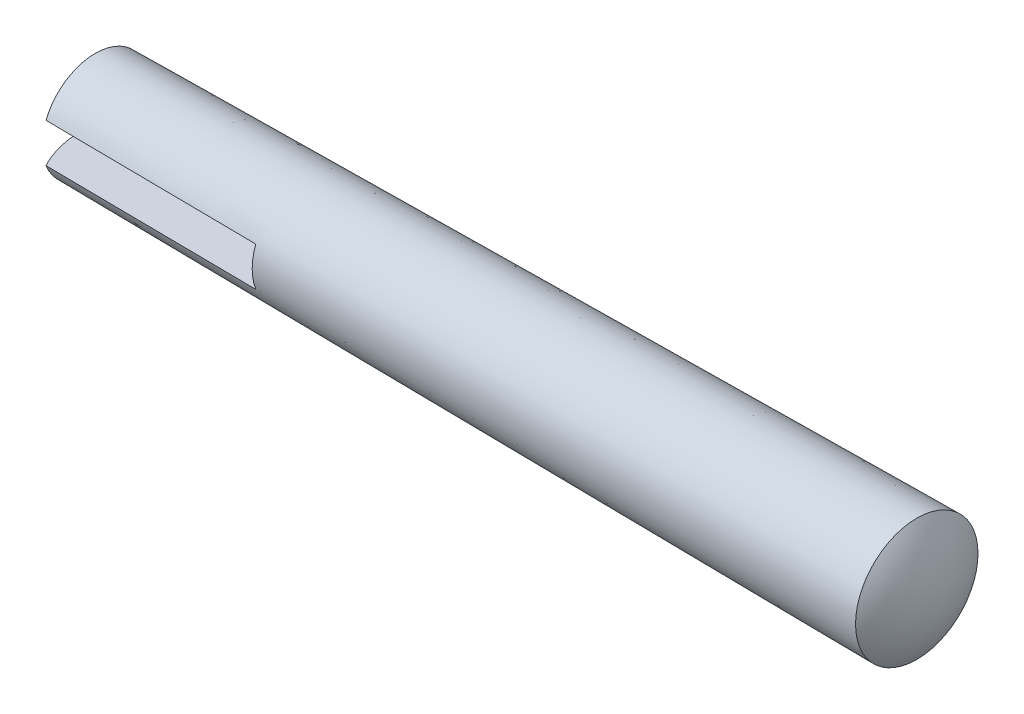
SolidWorks part; units mm, degrees
ref_plane "Plane1" through (0, 0, 0) normal (0, 0, 1) x (1, 0, 0)
ref_plane "Plane2" through (0, 0, 0) normal (0, 1, 0) x (1, 0, 0)
ref_plane "Plane3" through (0, 0, 0) normal (1, 0, 0) x (0, 0, -1)
sketch "Clipboard" plane through (0, 0, 0) normal (0, 0, 1) x (1, 0, 0)
  line L0 (0, 0) -> (10, 0)
  dimension "D1" = 10
sketch "BodySke" plane through (0, 0, 0) normal (0, 0, 1) x (1, 0, 0)
  line L0 (-0.6699, 0) -> (210, 0) construction
  line L1 (60, 0) -> (-0.6699, 0) construction
  line L2 (0, 2.5) -> (38.74, 2.8874)
  line L3 (0, 0) -> (0, 10) construction
  line L4 (-0.6699, 0) -> (39.658, 0)
  arc A0 (0, 2.5) -> (-0.6699, 0) centre (4.3301, 0) ccw
  arc A1 (38.74, 2.8874) -> (39.658, 0) centre (34.658, 0) cw
  dimension "D3" = 5
  dimension "D1" = 5
  dimension "Diameter" = 5
  dimension "D2" = 0.573
  dimension "Length" = 38.74
revolve "Body" add sketch "BodySke" angle 360 about L0
sketch "SplSke" plane through (0, 0, 0) normal (1, 0, 0) x (0, 0, -1)
  line L0 (0, 2) -> (0, -2) construction
  line L1 (2.8874, -0.9251) -> (-2.8874, -0.9251)
  line L2 (2.8874, -0.9251) -> (2.8874, 0.9251)
  line L3 (2.8874, 0.9251) -> (-2.8874, 0.9251)
  line L4 (-2.8874, -0.9251) -> (-2.8874, 0.9251)
  line L5 (2, 0) -> (-2, 0) construction
  circle A0 centre (0, 0) radius 2.8874 construction
  dimension "Width" = 1.8502
extrude "Split" cut sketch "SplSke" along normal blind 10 and the other way through all
equation "\"D1@BodySke\" = \"Diameter@BodySke\""
equation "\"D3@BodySke\" = \"Diameter@BodySke\""
